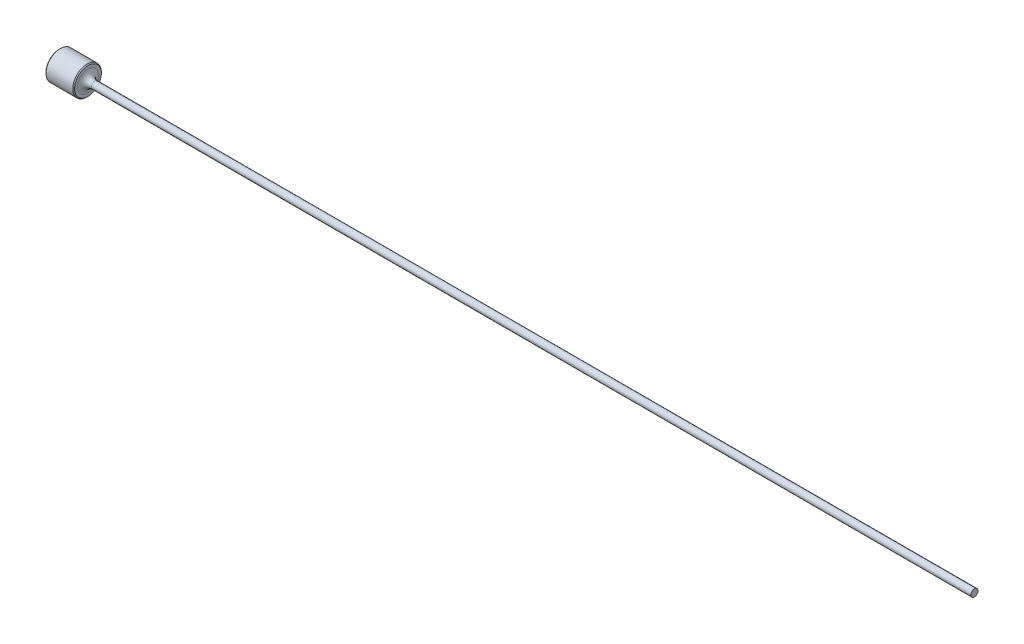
SolidWorks part; units mm, degrees
ref_plane "Front Plane" through (0, 0, 0) normal (0, 0, 1) x (1, 0, 0)
ref_plane "Top Plane" through (0, 0, 0) normal (0, 1, 0) x (1, 0, 0)
ref_plane "Right Plane" through (0, 0, 0) normal (1, 0, 0) x (0, 0, -1)
sketch "Sketch1" plane through (0, 0, 0) normal (0, 0, 1) x (1, 0, 0)
  line L0 (0, 0) -> (0, 1.5875)
  line L1 (0, 1.5875) -> (3.175, 1.5875)
  line L2 (3.175, 1.5875) -> (3.175, 1.1551)
  line L3 (3.937, 0.3931) -> (101.6, 0.3931)
  line L4 (101.6, 0.3931) -> (101.6, 0)
  line L5 (101.6, 0) -> (0, 0)
  line L6 (101.6, 0) -> (101.6, -0.3931) construction
  line L7 (101.6, -0.3931) -> (3.175, -0.3931) construction
  line L8 (0, 0) -> (0, -1.5875) construction
  line L9 (0, -1.5875) -> (3.175, -1.5875) construction
  line L10 (3.175, -1.5875) -> (3.175, -0.3931) construction
  arc A0 (3.175, 1.1551) -> (3.937, 0.3931) centre (3.937, 1.1551) ccw
  dimension "D4" = 0.762
  dimension "L" = 101.6
  dimension "D" = 0.7861
  dimension "H" = 3.175
  dimension "T" = 3.175
revolve "Revolve1" add sketch "Sketch1" angle 360 about L5
chamfer "Chamfer1" distance 0.1016 angle 45 2 edges at (0, 1.5875, 0) (3.175, 1.5875, 0)
